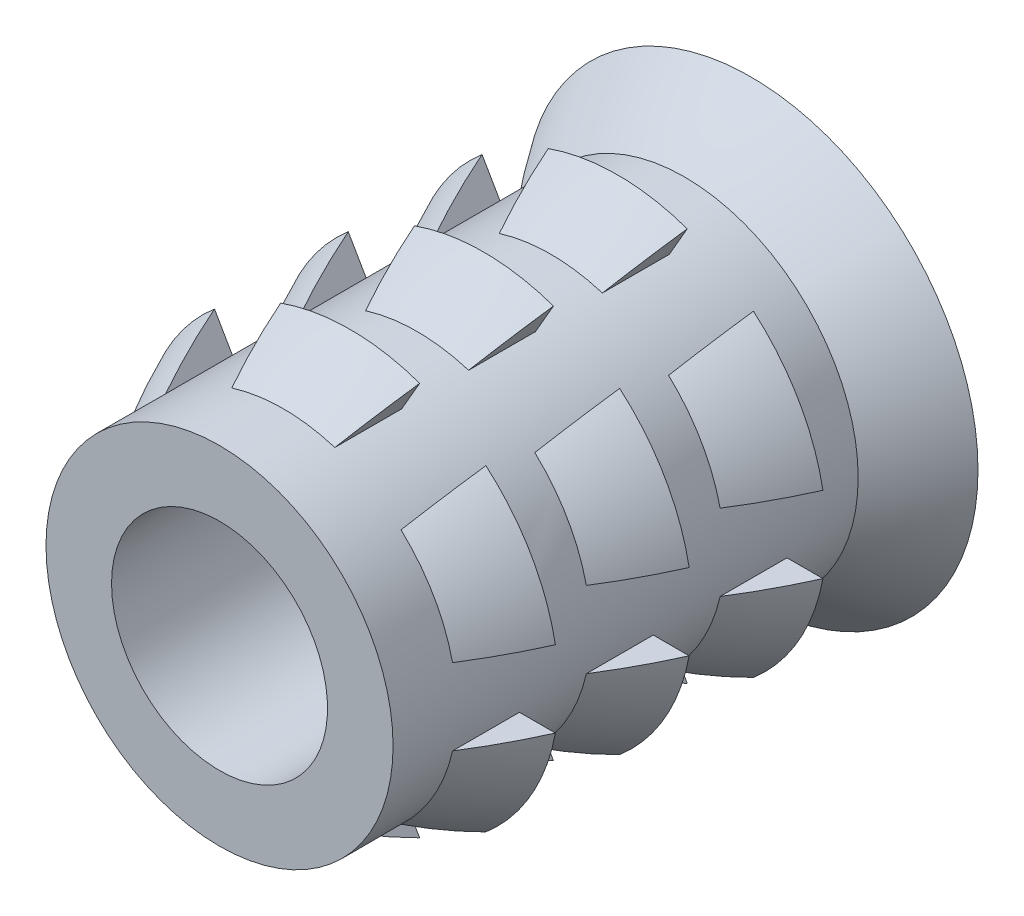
SolidWorks part; units mm, degrees
other "<insert 4-40(440S6-7)>-<CirPattern1>"
ref_plane "Front Plane" through (0, 0, 0) normal (0, 0, 1) x (1, 0, 0)
ref_plane "Top Plane" through (0, 0, 0) normal (0, 1, 0) x (1, 0, 0)
ref_plane "Right Plane" through (0, 0, 0) normal (1, 0, 0) x (0, 0, -1)
inserted part "insert 4-40(440S6-7)"
